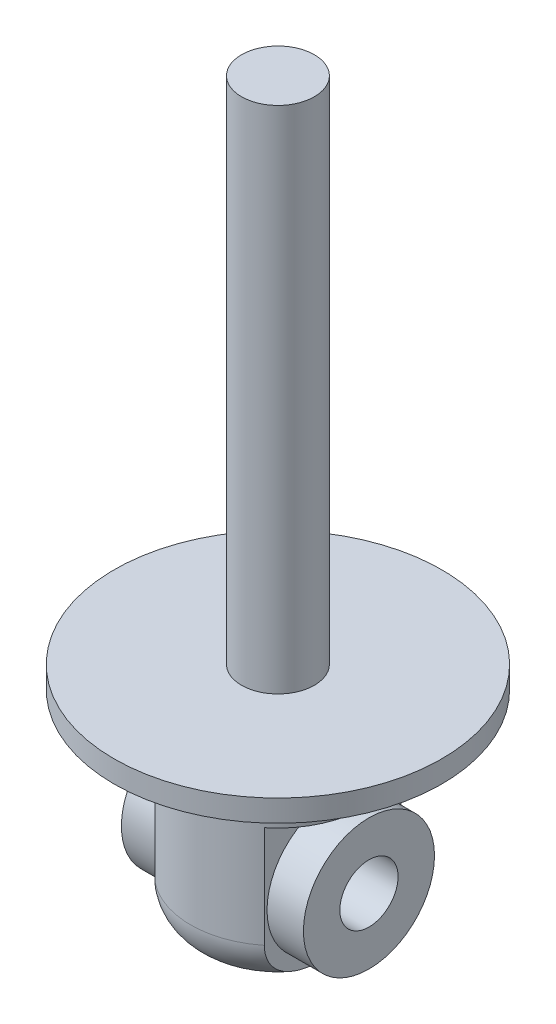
SolidWorks part; units mm, degrees
ref_plane "Front Plane" through (0, 0, 0) normal (0, 0, 1) x (1, 0, 0)
ref_plane "Top Plane" through (0, 0, 0) normal (0, 1, 0) x (1, 0, 0)
ref_plane "Right Plane" through (0, 0, 0) normal (1, 0, 0) x (0, 0, -1)
sketch "Sketch2" plane through (0, 0, 0) normal (0, 1, 0) x (1, 0, 0)
  circle A0 centre (0, 0) radius 22.5
  dimension "D1" = 45
extrude "Boss-Extrude1" add sketch "Sketch2" along normal blind 3
sketch "Sketch3" plane through (0, 3, 0) normal (0, 1, 0) x (1, 0, 0)
  circle A0 centre (0, 0) radius 5
  dimension "D1" = 10
extrude "Boss-Extrude2" add sketch "Sketch3" along normal blind 70
sketch "Sketch4" plane through (0, 0, 0) normal (0, -1, 0) x (1, 0, 0)
  circle A0 centre (0, 0) radius 12
  dimension "D1" = 24
extrude "Boss-Extrude3" add sketch "Sketch4" along normal blind 28
fillet "Fillet1" radius 6 1 edges at (0, -28, -12)
sketch "Sketch5" plane through (0, 0, 0) normal (0, 0, 1) x (1, 0, 0)
  line L0 (0, -30.8881) -> (0, 84.4121) construction
  line L1 (7.5, -28) -> (7.5, -8)
  line L2 (-6, -28) -> (6, -28) construction
  line L3 (7.5, -8) -> (30.3284, -8)
  line L4 (7.5, -28) -> (30.3284, -28)
  line L5 (30.3284, -28) -> (30.3284, -8)
  line L6 (-30.3284, -28) -> (-30.3284, -8)
  line L7 (-7.5, -28) -> (-30.3284, -28)
  line L8 (-7.5, -8) -> (-30.3284, -8)
  line L9 (-7.5, -28) -> (-7.5, -8)
  dimension "D1" = 15
  dimension "D2" = 20
extrude "Cut-Extrude1" cut sketch "Sketch5" against normal through all both and the other way through all
sketch "Sketch6" plane through (7.5, 0, 0) normal (1, 0, 0) x (0, 0, -1)
  line L0 (-6, -28) -> (6, -28) construction
  circle A0 centre (0, -18) radius 4
  dimension "D1" = 8
  dimension "D2" = 10
extrude "Cut-Extrude2" cut sketch "Sketch6" against normal through all both
sketch "Sketch7" plane through (0, 0, 0) normal (1, 0, 0) x (0, 0, -1)
  circle A0 centre (0, -18) radius 9
  circle A1 centre (0, -18) radius 4 construction
  circle A2 centre (0, -18) radius 4
  dimension "D1" = 18
extrude "Boss-Extrude4" add sketch "Sketch7" along normal mid plane 25
